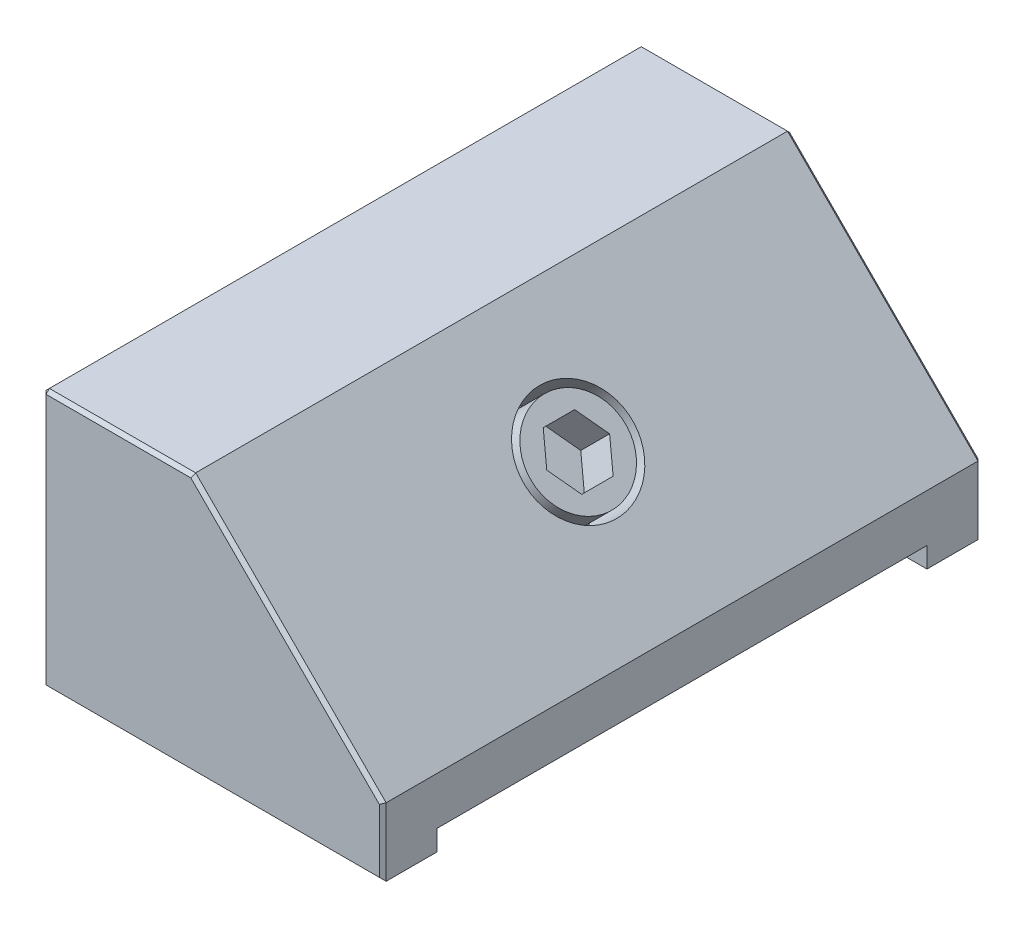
SolidWorks part; units mm, degrees
ref_plane "Face" through (0, 0, 0) normal (0, 0, 1) x (1, 0, 0)
ref_plane "Dessus" through (0, 0, 0) normal (0, 1, 0) x (1, 0, 0)
ref_plane "Droite" through (0, 0, 0) normal (1, 0, 0) x (0, 0, -1)
sketch "Esquisse1" plane through (0, 0, 0) normal (0, 0, 1) x (1, 0, 0)
  line L0 (0, 0) -> (0, 38)
  line L1 (0, 38) -> (22, 38)
  line L2 (22, 38) -> (50, 10)
  line L3 (50, 10) -> (50, 0)
  line L4 (50, 0) -> (0, 0)
  dimension "D1" = 38
  dimension "D2" = 50
  dimension "D3" = 45
  dimension "D4" = 10
extrude "Extrusion1" add sketch "Esquisse1" along normal mid plane 88
sketch "Esquisse2" plane through (0, 0, 0) normal (0, -1, 0) x (1, 0, 0)
  line L0 (50, 44) -> (50, -44) construction
  line L1 (50, 36) -> (0, 36)
  line L2 (50, 36) -> (50, -36)
  line L3 (50, -36) -> (0, -36)
  line L4 (0, 36) -> (0, -36)
  line L5 (0, 44) -> (0, -44) construction
  line L6 (0, -44) -> (50, -44) construction
  line L7 (0, 44) -> (50, 44) construction
  dimension "D1" = 8
  dimension "D2" = 8
extrude "Enlèv. mat.-Extru.1" cut sketch "Esquisse2" against normal blind 3
chamfer "Chanfrein1" distance 0.5 angle 45 11 edges at (36, 24, 44) (11, 38, 44) (0, 19, 44) (25, 0, 44) (0, 19, -44) (11, 38, -44) (36, 24, -44) (50, 5, -44) (25, 0, -44) (50, 5, 44) (0, 38, 0)
sketch "Esquisse3" plane through (30, 30, 0) normal (0.7071, 0.7071, 0) x (-0.7071, 0.7071, 0)
  line L0 (-28.0772, 44) -> (11.1066, 44) construction
  line L1 (11.3137, 43.5) -> (11.3137, -43.5) construction
  circle A0 centre (-6.6863, 0) radius 8
  dimension "D1" = 44
  dimension "D2" = 18
  dimension "D3" = 16
extrude "Enlèv. mat.-Extru.2" cut sketch "Esquisse3" against normal blind 10
sketch "Esquisse4" plane through (22.9289, 22.9289, 0) normal (0.7071, 0.7071, 0) x (-0.7071, 0.7071, 0)
  circle A0 centre (-6.6863, 0) radius 7
  circle A1 centre (-6.6863, 0) radius 8 construction
  dimension "D1" = 14
extrude "Extrusion2" add sketch "Esquisse4" along normal blind 10
sketch "Esquisse5" plane through (30, 30, 0) normal (0.7071, 0.7071, 0) x (-0.7071, 0.7071, 0)
  line L1 (-2.6863, -2.3094) -> (-2.6863, 2.3094)
  line L2 (-2.6863, 2.3094) -> (-6.6863, 4.6188)
  line L3 (-6.6863, 4.6188) -> (-10.6863, 2.3094)
  line L4 (-10.6863, 2.3094) -> (-10.6863, -2.3094)
  line L5 (-10.6863, -2.3094) -> (-6.6863, -4.6188)
  line L6 (-6.6863, -4.6188) -> (-2.6863, -2.3094)
  circle A0 centre (-6.6863, 0) radius 4 construction
  circle A1 centre (-6.6863, 0) radius 7 construction
  dimension "D1" = 8
extrude "Enlèv. mat.-Extru.3" cut sketch "Esquisse5" against normal blind 6
